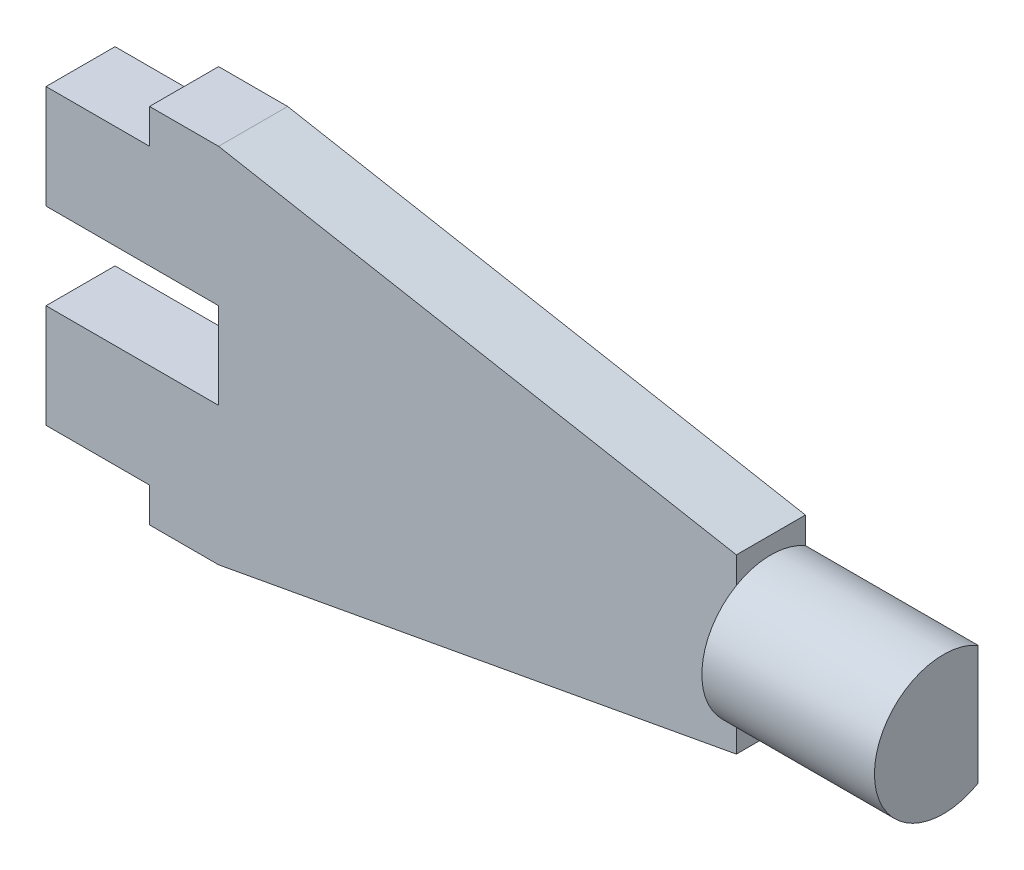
SolidWorks part; units mm, degrees
ref_plane "Plan de face" through (0, 0, 0) normal (0, 0, 1) x (1, 0, 0)
ref_plane "Plan de dessus" through (0, 0, 0) normal (0, 1, 0) x (1, 0, 0)
ref_plane "Plan de droite" through (0, 0, 0) normal (1, 0, 0) x (0, 0, -1)
sketch "Esquisse1" plane through (0, 0, 0) normal (0, 0, 1) x (1, 0, 0)
  line L0 (0, 0) -> (25, 0) construction
  line L1 (0, -4.25) -> (0, 4.25)
  line L2 (0, 4.25) -> (3, 4.25)
  line L3 (3, 4.25) -> (3, 5.25)
  line L4 (3, 5.25) -> (5, 5.25)
  line L5 (5, 5.25) -> (20, 2.5)
  line L6 (20, 2.5) -> (25, 2.5)
  line L7 (25, 2.5) -> (25, -2.5)
  line L8 (20, -2.5) -> (25, -2.5)
  line L9 (5, -5.25) -> (20, -2.5)
  line L10 (3, -5.25) -> (5, -5.25)
  line L11 (3, -4.25) -> (3, -5.25)
  line L12 (0, -4.25) -> (3, -4.25)
  dimension "D1" = 8.5
  dimension "D2" = 3
  dimension "D3" = 2
  dimension "D4" = 5
  dimension "D5" = 17
  dimension "D6" = 5
  dimension "D7" = 1
extrude "Boss.-Extru.1" add sketch "Esquisse1" along normal blind 2
sketch "Esquisse2" plane through (0, 0, 2) normal (0, 0, 1) x (1, 0, 0)
  line L0 (0, 0) -> (5, 0) construction
  line L1 (0, 4.25) -> (0, -4.25) construction
  line L2 (0, 1.25) -> (5, 1.25)
  line L3 (5, 1.25) -> (5, -1.25)
  line L4 (0, -1.25) -> (5, -1.25)
  line L5 (3, 4.25) -> (0, 4.25) construction
  line L6 (0, 1.25) -> (0, -1.25)
  dimension "D1" = 3
  dimension "D2" = 5
extrude "Enlèv. mat.-Extru.1" cut sketch "Esquisse2" against normal through all
sketch "Esquisse3" plane through (0, 0, 2) normal (0, 0, 1) x (1, 0, 0)
  line L1 (25, -2.5) -> (20, -2.5)
  line L2 (25, -2.5) -> (25, 2.5)
  line L3 (25, 2.5) -> (20, 2.5)
  line L4 (20, -2.5) -> (20, 2.5)
extrude "Boss.-Extru.2" add sketch "Esquisse3" along normal blind 4
sketch "Esquisse4" plane through (25, 0, 0) normal (1, 0, 0) x (0, 0, -1)
  line L0 (0, -2.5) -> (0, 2.5) construction
  line L1 (-3, 0) -> (0, 0) construction
  line L2 (0, 1.7321) -> (0, -1.7321)
  arc A0 (0, 1.7321) -> (0, -1.7321) centre (-1, 0) ccw
  dimension "D1" = 2
  dimension "D2" = 3
  dimension "D3" = 1
extrude "Enlèv. mat.-Extru.2" cut sketch "Esquisse4" against normal blind 5 flip side to cut
